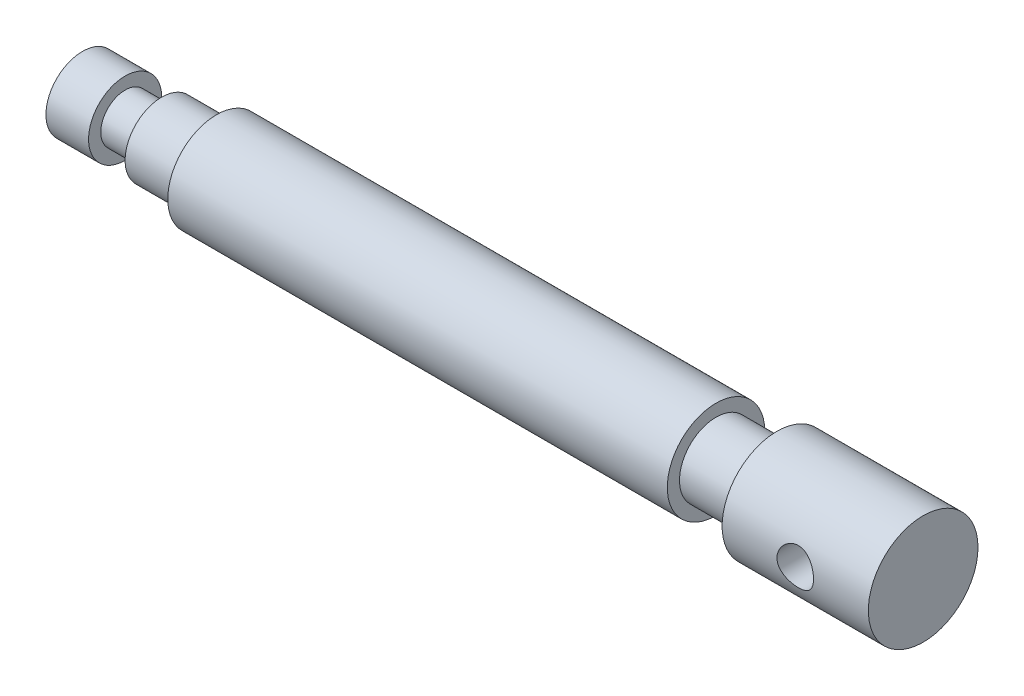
SolidWorks part; units mm, degrees
ref_plane "Front Plane" through (0, 0, 0) normal (0, 0, 1) x (1, 0, 0)
ref_plane "Top Plane" through (0, 0, 0) normal (0, 1, 0) x (1, 0, 0)
ref_plane "Right Plane" through (0, 0, 0) normal (1, 0, 0) x (0, 0, -1)
sketch "Sketch1" plane through (0, 0, 0) normal (0, 0, 1) x (1, 0, 0)
  line L0 (0, 0) -> (0, 6)
  line L1 (0, 6) -> (7, 6)
  line L2 (7, 6) -> (7, 4)
  line L3 (7, 4) -> (13, 4)
  line L4 (13, 4) -> (13, 6)
  line L5 (13, 6) -> (22, 6)
  line L6 (22, 6) -> (22, 8)
  line L7 (22, 8) -> (104, 8)
  line L8 (104, 8) -> (104, 6)
  line L9 (104, 6) -> (114, 6)
  line L10 (114, 6) -> (114, 9)
  line L11 (114, 9) -> (138, 9)
  line L12 (138, 9) -> (138, 0)
  line L13 (138, 0) -> (0, 0)
  line L14 (0, 0) -> (-26.12, 0) construction
  dimension "D1" = 12
  dimension "D2" = 8
  dimension "D3" = 16
  dimension "D4" = 7
  dimension "D5" = 6
  dimension "D6" = 82
  dimension "D7" = 10
  dimension "D8" = 24
  dimension "D9" = 18
  dimension "D10" = 138
revolve "Revolve1" add sketch "Sketch1" angle 360 about L14
sketch "Sketch2" plane through (0, 0, 0) normal (0, 0, 1) x (1, 0, 0)
  circle A0 centre (126, 0) radius 3
  dimension "D2" = 6
  dimension "D1" = 12
extrude "Cut-Extrude1" cut sketch "Sketch2" against normal mid plane 20
